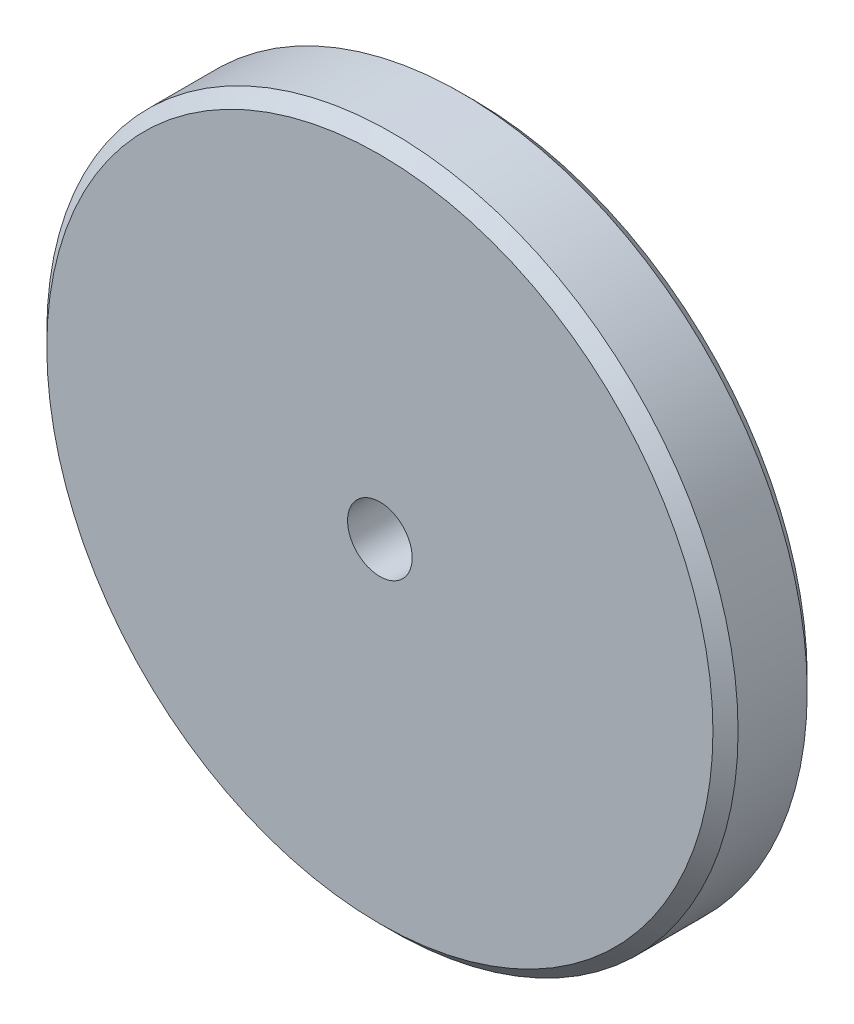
SolidWorks part; units mm, degrees
ref_plane "Front" through (0, 0, 0) normal (0, 0, 1) x (1, 0, 0)
ref_plane "Top" through (0, 0, 0) normal (0, 1, 0) x (1, 0, 0)
ref_plane "Right" through (0, 0, 0) normal (1, 0, 0) x (0, 0, -1)
sketch "Sketch1" plane through (0, 0, 0) normal (0, 0, 1) x (1, 0, 0)
  circle A0 centre (0, 0) radius 34.925
  dimension "D1" = 69.85
extrude "Boss-Extrude1" add sketch "Sketch1" along normal blind 9.525
chamfer "Chamfer1" distance 1.27 angle 45 2 edges at (34.925, 0, 0) (34.925, 0, 9.525)
hole_wizard "F (0.257) Diameter Hole1" positions "Sketch3" profile "Sketch4" hole size "F" standard "ANSI Inch"
sketch "Sketch3" plane through (0, 0, 9.525) normal (0, 0, 1) x (1, 0, 0)
  point P0 (0, 0)
sketch "Sketch4" plane through (0, 0, 9.525) normal (1, 0, 0) x (0, -1, 0)
  line L0 (0, 0) -> (0, 9.525)
  line L1 (0, 9.525) -> (3.2639, 9.525)
  line L2 (3.2639, 9.525) -> (3.2639, 0)
  line L5 (3.2639, 0) -> (0, 0)
  line L11 (0, -6.35) -> (0, 107.95) construction
  dimension "Thru Hole Dia." = 6.5278
  dimension "Thru Hole Depth" = 9.525
